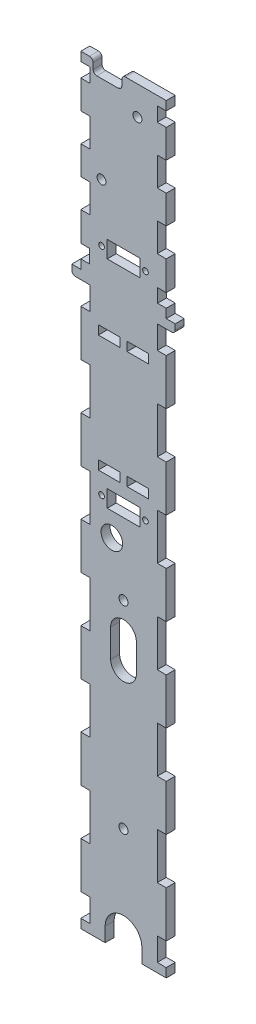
SolidWorks part; units mm, degrees
ref_plane "Front Plane" through (0, 0, 0) normal (0, 0, 1) x (1, 0, 0)
ref_plane "Top Plane" through (0, 0, 0) normal (0, 1, 0) x (1, 0, 0)
ref_plane "Right Plane" through (0, 0, 0) normal (1, 0, 0) x (0, 0, -1)
sketch "Sketch1" plane through (0, 0, 0) normal (0, 0, 1) x (1, 0, 0)
  line L1 (0, 0) -> (30.1798, 0)
  line L2 (0, 0) -> (0, 268.2875)
  line L3 (0, 268.2875) -> (30.1798, 268.2875)
  line L4 (30.1798, 0) -> (30.1798, 268.2875)
extrude "Boss-Extrude1" add sketch "Sketch1" along normal blind 3.175
sketch "Sketch3" plane through (0, 0, 0) normal (-1, 0, 0) x (0, 0, 1)
  line L0 (0, 268.2875) -> (0, 0) construction
  line L1 (0, 201.6125) -> (3.175, 201.6125)
  line L2 (0, 201.6125) -> (0, 198.4375)
  line L3 (0, 198.4375) -> (3.175, 198.4375)
  line L4 (3.175, 201.6125) -> (3.175, 198.4375)
  line L5 (3.175, 268.2875) -> (3.175, 0) construction
  line L6 (3.175, 0) -> (0, 0) construction
extrude "Boss-Extrude3" add sketch "Sketch3" along normal blind 3.175
ref_plane "Plane1" through (15.0899, 0, 0) normal (-1, 0, 0) x (0, 0, 1)
mirror "Mirror1" about plane through (15.0899, 0, 0) normal (-1, 0, 0) of "Boss-Extrude3"
sketch "Sketch4" plane through (0, 0, 3.175) normal (0, 0, 1) x (1, 0, 0)
  line L0 (0, 198.4375) -> (0, 0) construction
  line L5 (-3.175, 3.175) -> (3.175, 3.175)
  line L7 (15.0899, 0) -> (15.0899, 268.2875) construction
  line L8 (0, 0) -> (30.1798, 0) construction
  line L9 (30.1798, 268.2875) -> (0, 268.2875) construction
  line L22 (-3.175, 3.175) -> (-3.175, 11.3109)
  line L23 (-3.175, 11.3109) -> (3.175, 11.3109)
  line L28 (3.175, 3.175) -> (3.175, 11.3109)
  line L29 (-3.175, 3.175) -> (3.175, 11.3109) construction
  line L30 (-3.175, 11.3109) -> (3.175, 3.175) construction
  line L31 (33.3548, 11.3109) -> (27.0048, 11.3109)
  line L32 (27.0048, 3.175) -> (27.0048, 11.3109)
  line L33 (33.3548, 3.175) -> (27.0048, 3.175)
  line L34 (33.3548, 3.175) -> (33.3548, 11.3109)
  point P0 (0, 7.243)
extrude "Cut-Extrude1" cut sketch "Sketch4" against normal through all
sketch "Sketch5" plane through (0, 0, 3.175) normal (0, 0, 1) x (1, 0, 0)
  line L0 (0, 198.4375) -> (0, 11.3109) construction
  line L1 (-3.175, 43.8547) -> (3.175, 43.8547)
  line L2 (-3.175, 43.8547) -> (-3.175, 27.5828)
  line L3 (-3.175, 27.5828) -> (3.175, 27.5828)
  line L4 (3.175, 43.8547) -> (3.175, 27.5828)
  line L5 (-3.175, 43.8547) -> (3.175, 27.5828) construction
  line L6 (-3.175, 27.5828) -> (3.175, 43.8547) construction
  line L7 (0, 0) -> (30.1798, 0) construction
  line L8 (15.0899, 1.7463) -> (15.0899, -1.7463) construction
  line L9 (33.3548, 27.5828) -> (27.0048, 27.5828)
  line L10 (27.0048, 43.8547) -> (27.0048, 27.5828)
  line L11 (33.3548, 43.8547) -> (27.0048, 43.8547)
  line L12 (33.3548, 43.8547) -> (33.3548, 27.5828)
  point P0 (0, 35.7188)
extrude "Cut-Extrude2" cut sketch "Sketch5" against normal through all
pattern_linear "LPattern1" count 5 spacing 32.5437 along (0, 1, 0) of "Cut-Extrude2"
sketch "Sketch6" plane through (0, 0, 3.175) normal (0, 0, 1) x (1, 0, 0)
  line L0 (0, 198.4375) -> (0, 174.0297) construction
  line L1 (3.175, 190.3016) -> (-3.175, 190.3016)
  line L2 (3.175, 190.3016) -> (3.175, 198.4375)
  line L3 (3.175, 198.4375) -> (-3.175, 198.4375)
  line L4 (-3.175, 190.3016) -> (-3.175, 198.4375)
  line L5 (3.175, 190.3016) -> (-3.175, 198.4375) construction
  line L6 (3.175, 198.4375) -> (-3.175, 190.3016) construction
  line L7 (15.0899, 1.7463) -> (15.0899, -1.7463) construction
  line L8 (27.0048, 198.4375) -> (33.3548, 198.4375)
  line L9 (33.3548, 190.3016) -> (33.3548, 198.4375)
  line L10 (27.0048, 190.3016) -> (33.3548, 190.3016)
  line L11 (27.0048, 190.3016) -> (27.0048, 198.4375)
  point P0 (0, 194.3695)
extrude "Cut-Extrude3" cut sketch "Sketch6" against normal through all
sketch "Sketch7" plane through (0, 0, 3.175) normal (0, 0, 1) x (1, 0, 0)
  line L0 (0, 268.2875) -> (0, 201.6125) construction
  line L1 (-3.0764, 209.55) -> (3.0764, 209.55)
  line L2 (-3.0764, 209.55) -> (-3.0764, 204.7875)
  line L3 (-3.0764, 204.7875) -> (3.0764, 204.7875)
  line L4 (3.0764, 209.55) -> (3.0764, 204.7875)
  line L5 (-3.0764, 209.55) -> (3.0764, 204.7875) construction
  line L6 (-3.0764, 204.7875) -> (3.0764, 209.55) construction
  line L7 (-3.175, 201.6125) -> (0, 201.6125) construction
  line L8 (15.0899, 1.7463) -> (15.0899, -1.7463) construction
  line L9 (33.2562, 204.7875) -> (27.1035, 204.7875)
  line L10 (27.1035, 209.55) -> (27.1035, 204.7875)
  line L11 (33.2562, 209.55) -> (27.1035, 209.55)
  line L12 (33.2562, 209.55) -> (33.2562, 204.7875)
  point P0 (0, 207.1687)
extrude "Cut-Extrude4" cut sketch "Sketch7" against normal through all
sketch "Sketch8" plane through (0, 0, 3.175) normal (0, 0, 1) x (1, 0, 0)
  line L0 (0, 268.2875) -> (0, 209.55) construction
  line L1 (-3.175, 229.9229) -> (3.175, 229.9229)
  line L2 (-3.175, 229.9229) -> (-3.175, 219.8687)
  line L3 (-3.175, 219.8687) -> (3.175, 219.8687)
  line L4 (3.175, 229.9229) -> (3.175, 219.8687)
  line L5 (-3.175, 229.9229) -> (3.175, 219.8687) construction
  line L6 (-3.175, 219.8687) -> (3.175, 229.9229) construction
  line L7 (-3.175, 201.6125) -> (0, 201.6125) construction
  line L8 (15.0899, 1.7463) -> (15.0899, -1.7463) construction
  line L9 (33.3548, 219.8687) -> (27.0048, 219.8687)
  line L10 (27.0048, 229.9229) -> (27.0048, 219.8687)
  line L11 (33.3548, 229.9229) -> (27.0048, 229.9229)
  line L12 (33.3548, 229.9229) -> (33.3548, 219.8687)
  point P0 (0, 224.8958)
extrude "Cut-Extrude5" cut sketch "Sketch8" against normal through all
pattern_linear "LPattern3" count 2 spacing 20.1083 along (0, 1, 0) of "Cut-Extrude5"
sketch "Sketch9" plane through (0, 0, 3.175) normal (0, 0, 1) x (1, 0, 0)
  line L0 (0, 268.2875) -> (0, 250.0312) construction
  line L1 (-3.175, 260.0854) -> (3.175, 260.0854)
  line L2 (-3.175, 260.0854) -> (-3.175, 265.1125)
  line L3 (-3.175, 265.1125) -> (3.175, 265.1125)
  line L4 (3.175, 260.0854) -> (3.175, 265.1125)
  line L5 (-3.175, 260.0854) -> (3.175, 265.1125) construction
  line L6 (-3.175, 265.1125) -> (3.175, 260.0854) construction
  line L7 (30.1798, 268.2875) -> (0, 268.2875) construction
  line L8 (15.0899, 1.7463) -> (15.0899, -1.7463) construction
  line L9 (33.3548, 265.1125) -> (27.0048, 265.1125)
  line L10 (27.0048, 260.0854) -> (27.0048, 265.1125)
  line L11 (33.3548, 260.0854) -> (27.0048, 260.0854)
  line L12 (33.3548, 260.0854) -> (33.3548, 265.1125)
  point P0 (0, 262.599)
extrude "Cut-Extrude6" cut sketch "Sketch9" against normal through all
hole_wizard "1/8 (0.125) Diameter Hole1" positions "Sketch14" profile "Sketch15" hole size "1/8" standard "ANSI Inch"
sketch "Sketch14" plane through (0, 0, 3.175) normal (0, 0, 1) x (1, 0, 0)
  line L3 (30.1798, 250.0312) -> (30.1798, 260.0854) construction
  line L4 (30.1798, 268.2875) -> (0, 268.2875) construction
  line L5 (30.1798, 229.9229) -> (30.1798, 239.9771) construction
  point P0 (20.0198, 258.1275)
  point P2 (7.3198, 232.7275)
  dimension "D1" = 10.16
  dimension "D2" = 10.16
  dimension "D3" = 25.4
  dimension "D4" = 22.86
sketch "Sketch15" plane through (20.0198, 258.1275, 3.175) normal (1, 0, 0) x (0, -1, 0)
  line L0 (0, 0) -> (0, 3.175)
  line L1 (0, 3.175) -> (1.5875, 3.175)
  line L2 (1.5875, 3.175) -> (1.5875, 0)
  line L5 (1.5875, 0) -> (0, 0)
  line L11 (0, -6.35) -> (0, 107.95) construction
  dimension "Thru Hole Dia." = 3.175
  dimension "Thru Hole Depth" = 3.175
sketch "Sketch17" plane through (0, 0, 3.175) normal (0, 0, 1) x (1, 0, 0)
  line L0 (15.0899, 0) -> (15.0899, 31.7247) construction
  line L1 (15.0899, 1.7463) -> (15.0899, -1.7463) construction
  line L2 (0, 0) -> (30.1798, 0) construction
  line L4 (8.6129, 5.08) -> (8.6129, 0)
  line L5 (8.6129, 0) -> (21.5669, 0)
  line L6 (21.5669, 5.08) -> (21.5669, 0)
  line L7 (8.6129, 5.08) -> (21.5669, 0) construction
  line L8 (8.6129, 0) -> (21.5669, 5.08) construction
  arc A0 (21.5669, 5.08) -> (8.6129, 5.08) centre (15.0899, 5.08) ccw
  point P4 (15.0899, 2.54)
  dimension "D1" = 12.954
  dimension "D2" = 5.08
extrude "Cut-Extrude10" cut sketch "Sketch17" against normal through all
sketch "Sketch21" plane through (0, 0, 3.175) normal (0, 0, 1) x (1, 0, 0)
  line L0 (15.0899, 268.2875) -> (15.0899, 11.557) construction
  line L1 (30.1798, 268.2875) -> (0, 268.2875) construction
  line L2 (0, 186.1931) -> (30.1798, 186.1931) construction
  line L3 (23.9799, 184.6056) -> (16.3599, 187.7806) construction
  line L4 (6.1999, 187.7806) -> (13.8199, 187.7806)
  line L5 (0, 144.9181) -> (30.1798, 144.9181) construction
  line L6 (0, 157.7578) -> (0, 141.4859) construction
  line L7 (30.1798, 141.4859) -> (30.1798, 157.7578) construction
  line L8 (0, 190.3016) -> (0, 174.0297) construction
  line L9 (30.1798, 174.0297) -> (30.1798, 190.3016) construction
  line L10 (6.1999, 187.7806) -> (6.1999, 184.6056)
  line L11 (6.1999, 184.6056) -> (13.8199, 184.6056)
  line L12 (13.8199, 187.7806) -> (13.8199, 184.6056)
  line L13 (6.1999, 187.7806) -> (13.8199, 184.6056) construction
  line L14 (6.1999, 184.6056) -> (13.8199, 187.7806) construction
  line L15 (23.9799, 187.7806) -> (16.3599, 184.6056) construction
  line L16 (16.3599, 187.7806) -> (16.3599, 184.6056)
  line L17 (23.9799, 184.6056) -> (16.3599, 184.6056)
  line L18 (23.9799, 187.7806) -> (23.9799, 184.6056)
  line L19 (23.9799, 187.7806) -> (16.3599, 187.7806)
  line L20 (6.1999, 146.5056) -> (13.8199, 146.5056)
  line L21 (6.1999, 146.5056) -> (6.1999, 143.3306)
  line L22 (6.1999, 143.3306) -> (13.8199, 143.3306)
  line L23 (13.8199, 146.5056) -> (13.8199, 143.3306)
  line L24 (16.3599, 146.5056) -> (16.3599, 143.3306)
  line L25 (23.9799, 143.3306) -> (16.3599, 143.3306)
  line L26 (23.9799, 146.5056) -> (23.9799, 143.3306)
  line L27 (23.9799, 146.5056) -> (16.3599, 146.5056)
  line L28 (0, 144.9181) -> (30.1798, 144.9181) construction
  line L29 (23.9799, 143.3306) -> (16.3599, 146.5056) construction
  line L30 (6.1999, 146.5056) -> (13.8199, 143.3306) construction
  line L31 (6.1999, 143.3306) -> (13.8199, 146.5056) construction
  line L32 (23.9799, 146.5056) -> (16.3599, 143.3306) construction
  arc A0 (21.5669, 5.08) -> (8.6129, 5.08) centre (15.0899, 5.08) ccw construction
  point P19 (10.0099, 186.1931)
  point P28 (20.1699, 186.1931)
  point P33 (10.0099, 144.9181)
  point P42 (20.1699, 144.9181)
  dimension "D1" = 41.275
  dimension "D2" = 3.175
  dimension "D3" = 7.62
  dimension "D4" = 1.27
  dimension "D5" = 2
extrude "Cut-Extrude11" cut sketch "Sketch21" against normal through all
hole_wizard "M3 Clearance Hole1" positions "Sketch22" profile "Sketch23" hole size "M3" standard "ANSI Metric"
sketch "Sketch22" plane through (0, 0, 3.175) normal (0, 0, 1) x (1, 0, 0)
  line L0 (15.0899, 11.557) -> (15.0899, 150.7377) construction
  arc A0 (21.5669, 5.08) -> (8.6129, 5.08) centre (15.0899, 5.08) ccw construction
  point P9 (15.0899, 38.1)
  point P11 (15.0899, 107.95)
  point P16 (15.0899, 38.1)
  dimension "D1" = 69.85
sketch "Sketch23" plane through (15.0899, 38.1, 3.175) normal (1, 0, 0) x (0, -1, 0)
  line L0 (0, 0) -> (0, 3.175)
  line L1 (0, 3.175) -> (1.6, 3.175)
  line L2 (1.6, 3.175) -> (1.6, 0)
  line L5 (1.6, 0) -> (0, 0)
  line L11 (0, -6.35) -> (0, 107.95) construction
  dimension "Thru Hole Dia." = 3.2
  dimension "Thru Hole Depth" = 3.175
sketch "Sketch24" plane through (0, 0, 3.175) normal (0, 0, 1) x (1, 0, 0)
  line L0 (15.0899, 11.557) -> (15.0899, 160.4122) construction
  line L1 (15.0899, 1.7463) -> (15.0899, -1.7463) construction
  line L4 (15.0899, 97.536) -> (15.0899, 87.63) construction
  line L5 (19.6286, 97.536) -> (19.6286, 87.63)
  line L6 (10.5512, 97.536) -> (10.5512, 87.63)
  arc A0 (21.5669, 5.08) -> (8.6129, 5.08) centre (15.0899, 5.08) ccw construction
  arc A5 (19.6286, 97.536) -> (10.5512, 97.536) centre (15.0899, 97.536) ccw
  arc A6 (10.5512, 87.63) -> (19.6286, 87.63) centre (15.0899, 87.63) ccw
  point P9 (15.0899, 92.583)
extrude "Cut-Extrude12" cut sketch "Sketch24" against normal through all
sketch "Sketch25" plane through (0, 0, 3.175) normal (0, 0, 1) x (1, 0, 0)
  circle A0 centre (10.9629, 124.9894) radius 3.81
  dimension "D1" = 7.62
extrude "Cut-Extrude13" cut sketch "Sketch25" against normal through all
sketch "Sketch27" plane through (0, 0, 3.175) normal (0, 0, 1) x (1, 0, 0)
  line L0 (14.5192, 268.2875) -> (14.5192, 263.5871)
  line L1 (30.1798, 268.2875) -> (0, 268.2875) construction
  line L2 (14.5192, 263.5871) -> (4.3592, 263.5871)
  line L3 (4.3592, 263.5871) -> (4.3592, 268.2875)
  line L4 (4.3592, 268.2875) -> (14.5192, 268.2875)
  dimension "D1" = 10.16
extrude "Cut-Extrude14" cut sketch "Sketch27" against normal through all
fillet "Fillet1" radius 1.27 2 edges at (14.5192, 268.2875, 1.5875) (4.3592, 268.2875, 1.5875)
fillet "Fillet2" radius 1.27 2 edges at (14.5192, 263.5871, 1.5875) (4.3592, 263.5871, 1.5875)
fillet "Fillet3" radius 1.27 2 edges at (-3.175, 198.4375, 1.5875) (33.3548, 198.4375, 1.5875)
sketch "Sketch28" plane through (0, 0, 3.175) normal (0, 0, 1) x (1, 0, 0)
  line L0 (15.0899, 11.557) -> (15.0899, 268.2875) construction
  line L1 (30.1798, 268.2875) -> (15.7892, 268.2875) construction
  line L3 (6.1999, 120.65) -> (23.9799, 120.65) construction
  line L4 (6.1999, 120.65) -> (6.1999, 25.4) construction
  line L5 (6.1999, 25.4) -> (23.9799, 25.4) construction
  line L6 (23.9799, 120.65) -> (23.9799, 25.4) construction
  line L7 (6.1999, 120.65) -> (23.9799, 25.4) construction
  line L8 (6.1999, 25.4) -> (23.9799, 120.65) construction
  line L9 (9.3368, 139.2101) -> (20.843, 139.2101)
  line L10 (9.3368, 139.2101) -> (9.3368, 133.2157)
  line L11 (9.3368, 133.2157) -> (20.843, 133.2157)
  line L12 (20.843, 139.2101) -> (20.843, 133.2157)
  line L13 (9.3368, 139.2101) -> (20.843, 133.2157) construction
  line L14 (9.3368, 133.2157) -> (20.843, 139.2101) construction
  line L15 (9.3368, 215.4425) -> (20.843, 215.4425)
  line L16 (9.3368, 215.4425) -> (9.3368, 209.4481)
  line L17 (9.3368, 209.4481) -> (20.843, 209.4481)
  line L18 (20.843, 215.4425) -> (20.843, 209.4481)
  line L19 (9.3368, 215.4425) -> (20.843, 209.4481) construction
  line L20 (9.3368, 209.4481) -> (20.843, 215.4425) construction
  arc A0 (21.5669, 5.08) -> (8.6129, 5.08) centre (15.0899, 5.08) ccw construction
  circle A1 centre (15.0899, 107.95) radius 1.6 construction
  circle A2 centre (15.0899, 107.95) radius 1.6 construction
  circle A3 centre (7.3429, 136.2129) radius 1.0033
  circle A4 centre (22.8369, 136.2129) radius 1.0033
  circle A5 centre (7.3429, 212.4453) radius 1.0033
  circle A6 centre (22.8369, 212.4453) radius 1.0033
  point P8 (15.0899, 73.025)
  point P16 (15.0899, 136.2129)
  point P25 (15.0899, 212.4453)
  dimension "D8" = 2.0066
  dimension "D9" = 2.0066
  dimension "D14" = 2.0066
  dimension "D15" = 2.0066
  dimension "D1" = 95.25
  dimension "D2" = 17.78
  dimension "D3" = 12.7
  dimension "D4" = 11.5062
  dimension "D5" = 5.9944
  dimension "D6" = 7.747
  dimension "D7" = 7.747
  dimension "D10" = 5.9944
  dimension "D11" = 11.5062
  dimension "D12" = 7.747
  dimension "D13" = 7.747
extrude "Cut-Extrude15" cut sketch "Sketch28" against normal through all
sketch "Sketch29" plane through (0, 0, 3.175) normal (0, 0, 1) x (1, 0, 0)
  line L111 (20.589, 209.7021) -> (20.589, 215.1885)
  line L112 (9.5908, 209.7021) -> (20.589, 209.7021)
  line L113 (9.5908, 215.1885) -> (9.5908, 209.7021)
  line L114 (20.589, 215.1885) -> (9.5908, 215.1885)
  line L115 (20.589, 209.7021) -> (20.589, 215.1885)
  line L116 (9.5908, 209.7021) -> (20.589, 209.7021)
  line L117 (9.5908, 215.1885) -> (9.5908, 209.7021)
  line L118 (20.589, 215.1885) -> (9.5908, 215.1885)
  line L123 (13.5659, 184.8596) -> (13.5659, 187.5266)
  line L124 (6.4539, 184.8596) -> (13.5659, 184.8596)
  line L125 (6.4539, 187.5266) -> (6.4539, 184.8596)
  line L126 (13.5659, 187.5266) -> (6.4539, 187.5266)
  line L127 (13.5659, 184.8596) -> (13.5659, 187.5266)
  line L128 (6.4539, 184.8596) -> (13.5659, 184.8596)
  line L129 (6.4539, 187.5266) -> (6.4539, 184.8596)
  line L130 (13.5659, 187.5266) -> (6.4539, 187.5266)
  line L136 (16.6139, 184.8596) -> (23.7259, 184.8596)
  line L137 (23.7259, 184.8596) -> (23.7259, 187.5266)
  line L138 (23.7259, 187.5266) -> (16.6139, 187.5266)
  line L139 (16.6139, 187.5266) -> (16.6139, 184.8596)
  line L140 (16.6139, 184.8596) -> (23.7259, 184.8596)
  line L141 (23.7259, 184.8596) -> (23.7259, 187.5266)
  line L142 (23.7259, 187.5266) -> (16.6139, 187.5266)
  line L143 (16.6139, 187.5266) -> (16.6139, 184.8596)
  line L155 (6.4539, 143.5846) -> (13.5659, 143.5846)
  line L156 (13.5659, 143.5846) -> (13.5659, 146.2516)
  line L157 (6.4539, 146.2516) -> (6.4539, 143.5846)
  line L158 (13.5659, 146.2516) -> (6.4539, 146.2516)
  line L159 (6.4539, 143.5846) -> (13.5659, 143.5846)
  line L160 (13.5659, 143.5846) -> (13.5659, 146.2516)
  line L161 (6.4539, 146.2516) -> (6.4539, 143.5846)
  line L162 (13.5659, 146.2516) -> (6.4539, 146.2516)
  line L171 (16.6139, 146.2516) -> (16.6139, 143.5846)
  line L172 (16.6139, 143.5846) -> (23.7259, 143.5846)
  line L173 (23.7259, 143.5846) -> (23.7259, 146.2516)
  line L174 (23.7259, 146.2516) -> (16.6139, 146.2516)
  line L175 (16.6139, 146.2516) -> (16.6139, 143.5846)
  line L176 (16.6139, 143.5846) -> (23.7259, 143.5846)
  line L177 (23.7259, 143.5846) -> (23.7259, 146.2516)
  line L178 (23.7259, 146.2516) -> (16.6139, 146.2516)
  line L183 (9.5908, 133.4697) -> (20.589, 133.4697)
  line L184 (20.589, 133.4697) -> (20.589, 138.9561)
  line L185 (20.589, 138.9561) -> (9.5908, 138.9561)
  line L186 (9.5908, 138.9561) -> (9.5908, 133.4697)
  line L187 (9.5908, 133.4697) -> (20.589, 133.4697)
  line L188 (20.589, 133.4697) -> (20.589, 138.9561)
  line L189 (20.589, 138.9561) -> (9.5908, 138.9561)
  line L190 (9.5908, 138.9561) -> (9.5908, 133.4697)
  line L191 (19.3746, 87.63) -> (19.3746, 97.536)
  line L192 (10.8052, 97.536) -> (10.8052, 87.63)
  line L193 (19.3746, 87.63) -> (19.3746, 97.536)
  line L194 (10.8052, 97.536) -> (10.8052, 87.63)
  line L206 (-3.429, 201.8665) -> (-3.429, 199.7075)
  line L207 (-1.905, 198.1835) -> (2.921, 198.1835)
  line L208 (2.921, 198.1835) -> (2.921, 190.5556)
  line L209 (2.921, 190.5556) -> (-0.254, 190.5556)
  line L210 (-0.254, 190.5556) -> (-0.254, 173.7757)
  line L211 (-0.254, 173.7757) -> (2.921, 173.7757)
  line L212 (2.921, 173.7757) -> (2.921, 158.0118)
  line L213 (2.921, 158.0118) -> (-0.254, 158.0118)
  line L214 (-0.254, 158.0118) -> (-0.254, 141.2319)
  line L215 (-0.254, 141.2319) -> (2.921, 141.2319)
  line L216 (2.921, 141.2319) -> (2.921, 125.4681)
  line L217 (2.921, 125.4681) -> (-0.254, 125.4681)
  line L218 (-0.254, 125.4681) -> (-0.254, 108.6882)
  line L219 (-0.254, 108.6882) -> (2.921, 108.6882)
  line L220 (2.921, 108.6882) -> (2.921, 92.9243)
  line L221 (2.921, 92.9243) -> (-0.254, 92.9243)
  line L222 (-0.254, 92.9243) -> (-0.254, 76.1444)
  line L223 (-0.254, 76.1444) -> (2.921, 76.1444)
  line L224 (2.921, 76.1444) -> (2.921, 60.3806)
  line L225 (2.921, 60.3806) -> (-0.254, 60.3806)
  line L226 (-0.254, 60.3806) -> (-0.254, 43.6007)
  line L227 (-0.254, 43.6007) -> (2.921, 43.6007)
  line L228 (2.921, 43.6007) -> (2.921, 27.8368)
  line L229 (2.921, 27.8368) -> (-0.254, 27.8368)
  line L230 (-0.254, 27.8368) -> (-0.254, 11.0569)
  line L231 (-0.254, 11.0569) -> (2.921, 11.0569)
  line L232 (2.921, 11.0569) -> (2.921, 3.429)
  line L233 (2.921, 3.429) -> (-0.254, 3.429)
  line L234 (-0.254, 3.429) -> (-0.254, -0.254)
  line L235 (-0.254, -0.254) -> (8.8669, -0.254)
  line L236 (8.8669, -0.254) -> (8.8669, 5.08)
  line L237 (21.3129, 5.08) -> (21.3129, -0.254)
  line L238 (21.3129, -0.254) -> (30.4338, -0.254)
  line L239 (30.4338, -0.254) -> (30.4338, 3.429)
  line L240 (30.4338, 3.429) -> (27.2588, 3.429)
  line L241 (27.2588, 3.429) -> (27.2588, 11.0569)
  line L242 (27.2588, 11.0569) -> (30.4338, 11.0569)
  line L243 (30.4338, 11.0569) -> (30.4338, 27.8368)
  line L244 (30.4338, 27.8368) -> (27.2588, 27.8368)
  line L245 (27.2588, 27.8368) -> (27.2588, 43.6007)
  line L246 (27.2588, 43.6007) -> (30.4338, 43.6007)
  line L247 (30.4338, 43.6007) -> (30.4338, 60.3806)
  line L248 (30.4338, 60.3806) -> (27.2588, 60.3806)
  line L249 (27.2588, 60.3806) -> (27.2588, 76.1444)
  line L250 (27.2588, 76.1444) -> (30.4338, 76.1444)
  line L251 (30.4338, 76.1444) -> (30.4338, 92.9243)
  line L252 (30.4338, 92.9243) -> (27.2588, 92.9243)
  line L253 (27.2588, 92.9243) -> (27.2588, 108.6882)
  line L254 (27.2588, 108.6882) -> (30.4338, 108.6882)
  line L255 (30.4338, 108.6882) -> (30.4338, 125.4681)
  line L256 (30.4338, 125.4681) -> (27.2588, 125.4681)
  line L257 (27.2588, 125.4681) -> (27.2588, 141.2319)
  line L258 (27.2588, 141.2319) -> (30.4338, 141.2319)
  line L259 (30.4338, 141.2319) -> (30.4338, 158.0118)
  line L260 (30.4338, 158.0118) -> (27.2588, 158.0118)
  line L261 (27.2588, 158.0118) -> (27.2588, 173.7757)
  line L262 (27.2588, 173.7757) -> (30.4338, 173.7757)
  line L263 (30.4338, 173.7757) -> (30.4338, 190.5556)
  line L264 (30.4338, 190.5556) -> (27.2588, 190.5556)
  line L265 (27.2588, 190.5556) -> (27.2588, 198.1835)
  line L266 (27.2588, 198.1835) -> (32.0848, 198.1835)
  line L267 (33.6088, 199.7075) -> (33.6088, 201.8665)
  line L268 (33.6088, 201.8665) -> (30.4338, 201.8665)
  line L269 (30.4338, 201.8665) -> (30.4338, 205.0415)
  line L270 (30.4338, 205.0415) -> (27.3575, 205.0415)
  line L271 (27.3575, 205.0415) -> (27.3575, 209.296)
  line L272 (27.3575, 209.296) -> (30.4338, 209.296)
  line L273 (30.4338, 209.296) -> (30.4338, 220.1227)
  line L274 (30.4338, 220.1227) -> (27.2588, 220.1227)
  line L275 (27.2588, 220.1227) -> (27.2588, 229.6689)
  line L276 (27.2588, 229.6689) -> (30.4338, 229.6689)
  line L277 (30.4338, 229.6689) -> (30.4338, 240.2311)
  line L278 (30.4338, 240.2311) -> (27.2588, 240.2311)
  line L279 (27.2588, 240.2311) -> (27.2588, 249.7772)
  line L280 (27.2588, 249.7772) -> (30.4338, 249.7772)
  line L281 (30.4338, 249.7772) -> (30.4338, 260.3394)
  line L282 (30.4338, 260.3394) -> (27.2588, 260.3394)
  line L283 (27.2588, 260.3394) -> (27.2588, 264.8585)
  line L284 (27.2588, 264.8585) -> (30.4338, 264.8585)
  line L285 (30.4338, 264.8585) -> (30.4338, 268.5415)
  line L286 (30.4338, 268.5415) -> (15.7892, 268.5415)
  line L287 (14.2652, 267.0175) -> (14.2652, 264.8571)
  line L288 (13.2492, 263.8411) -> (5.6292, 263.8411)
  line L289 (4.6132, 264.8571) -> (4.6132, 267.0175)
  line L290 (3.0892, 268.5415) -> (-0.254, 268.5415)
  line L291 (-0.254, 268.5415) -> (-0.254, 264.8585)
  line L292 (-0.254, 264.8585) -> (2.921, 264.8585)
  line L293 (2.921, 264.8585) -> (2.921, 260.3394)
  line L294 (2.921, 260.3394) -> (-0.254, 260.3394)
  line L295 (-0.254, 260.3394) -> (-0.254, 249.7772)
  line L296 (-0.254, 249.7772) -> (2.921, 249.7772)
  line L297 (2.921, 249.7772) -> (2.921, 240.2311)
  line L298 (2.921, 240.2311) -> (-0.254, 240.2311)
  line L299 (-0.254, 240.2311) -> (-0.254, 229.6689)
  line L300 (-0.254, 229.6689) -> (2.921, 229.6689)
  line L301 (2.921, 229.6689) -> (2.921, 220.1227)
  line L302 (2.921, 220.1227) -> (-0.254, 220.1227)
  line L303 (-0.254, 220.1227) -> (-0.254, 209.296)
  line L304 (-0.254, 209.296) -> (2.8224, 209.296)
  line L305 (2.8224, 209.296) -> (2.8224, 205.0415)
  line L306 (2.8224, 205.0415) -> (-0.254, 205.0415)
  line L307 (-0.254, 205.0415) -> (-0.254, 201.8665)
  line L308 (-0.254, 201.8665) -> (-3.429, 201.8665)
  line L309 (-3.429, 201.8665) -> (-3.429, 199.7075)
  line L310 (-1.905, 198.1835) -> (2.921, 198.1835)
  line L311 (2.921, 198.1835) -> (2.921, 190.5556)
  line L312 (2.921, 190.5556) -> (-0.254, 190.5556)
  line L313 (-0.254, 190.5556) -> (-0.254, 173.7757)
  line L314 (-0.254, 173.7757) -> (2.921, 173.7757)
  line L315 (2.921, 173.7757) -> (2.921, 158.0118)
  line L316 (2.921, 158.0118) -> (-0.254, 158.0118)
  line L317 (-0.254, 158.0118) -> (-0.254, 141.2319)
  line L318 (-0.254, 141.2319) -> (2.921, 141.2319)
  line L319 (2.921, 141.2319) -> (2.921, 125.4681)
  line L320 (2.921, 125.4681) -> (-0.254, 125.4681)
  line L321 (-0.254, 125.4681) -> (-0.254, 108.6882)
  line L322 (-0.254, 108.6882) -> (2.921, 108.6882)
  line L323 (2.921, 108.6882) -> (2.921, 92.9243)
  line L324 (2.921, 92.9243) -> (-0.254, 92.9243)
  line L325 (-0.254, 92.9243) -> (-0.254, 76.1444)
  line L326 (-0.254, 76.1444) -> (2.921, 76.1444)
  line L327 (2.921, 76.1444) -> (2.921, 60.3806)
  line L328 (2.921, 60.3806) -> (-0.254, 60.3806)
  line L329 (-0.254, 60.3806) -> (-0.254, 43.6007)
  line L330 (-0.254, 43.6007) -> (2.921, 43.6007)
  line L331 (2.921, 43.6007) -> (2.921, 27.8368)
  line L332 (2.921, 27.8368) -> (-0.254, 27.8368)
  line L333 (-0.254, 27.8368) -> (-0.254, 11.0569)
  line L334 (-0.254, 11.0569) -> (2.921, 11.0569)
  line L335 (2.921, 11.0569) -> (2.921, 3.429)
  line L336 (2.921, 3.429) -> (-0.254, 3.429)
  line L337 (-0.254, 3.429) -> (-0.254, -0.254)
  line L338 (-0.254, -0.254) -> (8.8669, -0.254)
  line L339 (8.8669, -0.254) -> (8.8669, 5.08)
  line L340 (21.3129, 5.08) -> (21.3129, -0.254)
  line L341 (21.3129, -0.254) -> (30.4338, -0.254)
  line L342 (30.4338, -0.254) -> (30.4338, 3.429)
  line L343 (30.4338, 3.429) -> (27.2588, 3.429)
  line L344 (27.2588, 3.429) -> (27.2588, 11.0569)
  line L345 (27.2588, 11.0569) -> (30.4338, 11.0569)
  line L346 (30.4338, 11.0569) -> (30.4338, 27.8368)
  line L347 (30.4338, 27.8368) -> (27.2588, 27.8368)
  line L348 (27.2588, 27.8368) -> (27.2588, 43.6007)
  line L349 (27.2588, 43.6007) -> (30.4338, 43.6007)
  line L350 (30.4338, 43.6007) -> (30.4338, 60.3806)
  line L351 (30.4338, 60.3806) -> (27.2588, 60.3806)
  line L352 (27.2588, 60.3806) -> (27.2588, 76.1444)
  line L353 (27.2588, 76.1444) -> (30.4338, 76.1444)
  line L354 (30.4338, 76.1444) -> (30.4338, 92.9243)
  line L355 (30.4338, 92.9243) -> (27.2588, 92.9243)
  line L356 (27.2588, 92.9243) -> (27.2588, 108.6882)
  line L357 (27.2588, 108.6882) -> (30.4338, 108.6882)
  line L358 (30.4338, 108.6882) -> (30.4338, 125.4681)
  line L359 (30.4338, 125.4681) -> (27.2588, 125.4681)
  line L360 (27.2588, 125.4681) -> (27.2588, 141.2319)
  line L361 (27.2588, 141.2319) -> (30.4338, 141.2319)
  line L362 (30.4338, 141.2319) -> (30.4338, 158.0118)
  line L363 (30.4338, 158.0118) -> (27.2588, 158.0118)
  line L364 (27.2588, 158.0118) -> (27.2588, 173.7757)
  line L365 (27.2588, 173.7757) -> (30.4338, 173.7757)
  line L366 (30.4338, 173.7757) -> (30.4338, 190.5556)
  line L367 (30.4338, 190.5556) -> (27.2588, 190.5556)
  line L368 (27.2588, 190.5556) -> (27.2588, 198.1835)
  line L369 (27.2588, 198.1835) -> (32.0848, 198.1835)
  line L370 (33.6088, 199.7075) -> (33.6088, 201.8665)
  line L371 (33.6088, 201.8665) -> (30.4338, 201.8665)
  line L372 (30.4338, 201.8665) -> (30.4338, 205.0415)
  line L373 (30.4338, 205.0415) -> (27.3575, 205.0415)
  line L374 (27.3575, 205.0415) -> (27.3575, 209.296)
  line L375 (27.3575, 209.296) -> (30.4338, 209.296)
  line L376 (30.4338, 209.296) -> (30.4338, 220.1227)
  line L377 (30.4338, 220.1227) -> (27.2588, 220.1227)
  line L378 (27.2588, 220.1227) -> (27.2588, 229.6689)
  line L379 (27.2588, 229.6689) -> (30.4338, 229.6689)
  line L380 (30.4338, 229.6689) -> (30.4338, 240.2311)
  line L381 (30.4338, 240.2311) -> (27.2588, 240.2311)
  line L382 (27.2588, 240.2311) -> (27.2588, 249.7772)
  line L383 (27.2588, 249.7772) -> (30.4338, 249.7772)
  line L384 (30.4338, 249.7772) -> (30.4338, 260.3394)
  line L385 (30.4338, 260.3394) -> (27.2588, 260.3394)
  line L386 (27.2588, 260.3394) -> (27.2588, 264.8585)
  line L387 (27.2588, 264.8585) -> (30.4338, 264.8585)
  line L388 (30.4338, 264.8585) -> (30.4338, 268.5415)
  line L389 (30.4338, 268.5415) -> (15.7892, 268.5415)
  line L390 (14.2652, 267.0175) -> (14.2652, 264.8571)
  line L391 (13.2492, 263.8411) -> (5.6292, 263.8411)
  line L392 (4.6132, 264.8571) -> (4.6132, 267.0175)
  line L393 (3.0892, 268.5415) -> (-0.254, 268.5415)
  line L394 (-0.254, 268.5415) -> (-0.254, 264.8585)
  line L395 (-0.254, 264.8585) -> (2.921, 264.8585)
  line L396 (2.921, 264.8585) -> (2.921, 260.3394)
  line L397 (2.921, 260.3394) -> (-0.254, 260.3394)
  line L398 (-0.254, 260.3394) -> (-0.254, 249.7772)
  line L399 (-0.254, 249.7772) -> (2.921, 249.7772)
  line L400 (2.921, 249.7772) -> (2.921, 240.2311)
  line L401 (2.921, 240.2311) -> (-0.254, 240.2311)
  line L402 (-0.254, 240.2311) -> (-0.254, 229.6689)
  line L403 (-0.254, 229.6689) -> (2.921, 229.6689)
  line L404 (2.921, 229.6689) -> (2.921, 220.1227)
  line L405 (2.921, 220.1227) -> (-0.254, 220.1227)
  line L406 (-0.254, 220.1227) -> (-0.254, 209.296)
  line L407 (-0.254, 209.296) -> (2.8224, 209.296)
  line L408 (2.8224, 209.296) -> (2.8224, 205.0415)
  line L409 (2.8224, 205.0415) -> (-0.254, 205.0415)
  line L410 (-0.254, 205.0415) -> (-0.254, 201.8665)
  line L411 (-0.254, 201.8665) -> (-3.429, 201.8665)
  circle A9 centre (20.0198, 258.1275) radius 1.3335
  circle A10 centre (20.0198, 258.1275) radius 1.3335
  circle A12 centre (7.3198, 232.7275) radius 1.3335
  circle A13 centre (7.3198, 232.7275) radius 1.3335
  arc A14 (-3.429, 199.7075) -> (-1.905, 198.1835) centre (-1.905, 199.7075) ccw
  arc A15 (21.3129, 5.08) -> (8.8669, 5.08) centre (15.0899, 5.08) ccw
  arc A16 (32.0848, 198.1835) -> (33.6088, 199.7075) centre (32.0848, 199.7075) ccw
  arc A17 (15.7892, 268.5415) -> (14.2652, 267.0175) centre (15.7892, 267.0175) ccw
  arc A18 (13.2492, 263.8411) -> (14.2652, 264.8571) centre (13.2492, 264.8571) ccw
  arc A19 (4.6132, 264.8571) -> (5.6292, 263.8411) centre (5.6292, 264.8571) ccw
  arc A20 (4.6132, 267.0175) -> (3.0892, 268.5415) centre (3.0892, 267.0175) ccw
  arc A21 (-3.429, 199.7075) -> (-1.905, 198.1835) centre (-1.905, 199.7075) ccw
  arc A22 (21.3129, 5.08) -> (8.8669, 5.08) centre (15.0899, 5.08) ccw
  arc A23 (32.0848, 198.1835) -> (33.6088, 199.7075) centre (32.0848, 199.7075) ccw
  arc A24 (15.7892, 268.5415) -> (14.2652, 267.0175) centre (15.7892, 267.0175) ccw
  arc A25 (13.2492, 263.8411) -> (14.2652, 264.8571) centre (13.2492, 264.8571) ccw
  arc A26 (4.6132, 264.8571) -> (5.6292, 263.8411) centre (5.6292, 264.8571) ccw
  arc A27 (4.6132, 267.0175) -> (3.0892, 268.5415) centre (3.0892, 267.0175) ccw
  circle A29 centre (22.8369, 212.4453) radius 0.7493
  circle A30 centre (22.8369, 212.4453) radius 0.7493
  circle A32 centre (7.3429, 212.4453) radius 0.7493
  circle A33 centre (7.3429, 212.4453) radius 0.7493
  circle A35 centre (7.3429, 136.2129) radius 0.7493
  circle A36 centre (7.3429, 136.2129) radius 0.7493
  circle A38 centre (22.8369, 136.2129) radius 0.7493
  circle A39 centre (22.8369, 136.2129) radius 0.7493
  circle A41 centre (10.9629, 124.9894) radius 3.556
  circle A42 centre (10.9629, 124.9894) radius 3.556
  circle A44 centre (15.0899, 107.95) radius 1.346
  circle A45 centre (15.0899, 107.95) radius 1.346
  arc A49 (10.8052, 87.63) -> (19.3746, 87.63) centre (15.0899, 87.63) ccw
  arc A50 (19.3746, 97.536) -> (10.8052, 97.536) centre (15.0899, 97.536) ccw
  arc A51 (10.8052, 87.63) -> (19.3746, 87.63) centre (15.0899, 87.63) ccw
  arc A52 (19.3746, 97.536) -> (10.8052, 97.536) centre (15.0899, 97.536) ccw
  circle A53 centre (15.0899, 38.1) radius 1.346
  circle A54 centre (15.0899, 38.1) radius 1.346
  dimension "D1" = 0.254
  dimension "D2" = 0.254
  dimension "D3" = 0.254
  dimension "D4" = 0.254
  dimension "D5" = 0.254
  dimension "D6" = 0.254
  dimension "D7" = 0.254
  dimension "D8" = 0.254
  dimension "D9" = 0.254
  dimension "D10" = 0.254
  dimension "D11" = 0.254
  dimension "D12" = 0.254
  dimension "D13" = 0.254
  dimension "D14" = 0.254
  dimension "D15" = 0.254
  dimension "D16" = 0.254
  dimension "D17" = 0.254
equation "\"t\"= .125in"
equation "\"dc\"= .1in"
equation "\"Db\"= 1.4in"
equation "\"hb\"= 8.0625in"
equation "\"ht\"= 2.5in"
equation "\"Nt\"= 3"
equation "\"Nb\"= 6"
equation "\"ce\"= .04in"
equation "\"MainHeight@Sketch1\"= \"hb\" + \"ht\""
equation "\"D1@Boss-Extrude1\"= \"t\""
equation "\"MainWidth@Sketch1\"= 2 * sqr ( ( \"Db\" / 2 - \"ce\" ) ^ 2 - ( \"dc\" + 1.5 * \"t\" ) ^ 2 )"
equation "\"D1@Sketch3\"= \"t\""
equation "\"D1@Boss-Extrude3\"= \"t\""
equation "\"D2@Sketch3\" = \"hb\" - 2 * \"t\""
equation "\"TwiceSlotDepth@Sketch5\"= 2 * \"t\""
equation "\"SlotHeight@Sketch5\"= ( \"hb\" - 3 * \"t\" ) / 2 / \"Nb\""
equation "\"SecondSlotLocation@Sketch5\"= \"t\" + 1.5 * ( \"hb\" - 3 * \"t\" ) / 2 / \"Nb\""
equation "\"D1@LPattern1\" = \"Nb\" - 1"
equation "\"D3@LPattern1\"= ( \"hb\" - 3 * \"t\" ) / \"Nb\""
equation "\"HalfSlotHeight@Sketch6\"= ( \"hb\" - 3 * \"t\" ) / 4 / \"Nb\""
equation "\"TopSllotStart@Sketch7\"= \"t\""
equation "\"TopHalfSlotHeight@Sketch7\" = ( \"ht\" - 2 * \"t\" ) / 4 / \"Nt\""
equation "\"TopSlotHeight@Sketch8\" = ( \"ht\" - \"t\" ) / 2 / \"Nt\""
equation "\"TwiceSlotDepth@Sketch8\"= 2 * \"t\""
equation "\"TopSlotPatternStart@Sketch8\" = \"t\" + 1.5 * ( \"ht\" - \"t\" ) / 2 / \"Nt\""
equation "\"D3@LPattern3\" = ( \"ht\" - \"t\" ) / \"Nt\""
equation "\"D1@LPattern3\" = \"Nt\" - 1"
equation "\"TopHalfSlotHeight@Sketch9\"= ( \"ht\" - \"t\" ) / 4 / \"Nt\""
equation "\"TwiceSlothWidth@Sketch9\"= 2 * \"t\""
equation "\"DToTop@Sketch9\"= \"t\""
equation "\"ToHalfSlot@Sketch4\"= \"t\""
equation "\"TwiceSlotWidth@Sketch4\"= 2 * \"t\""
equation "\"HalfSlotWidth@Sketch4\"= ( \"hb\" - 3 * \"t\" ) / 4 / \"Nb\""
